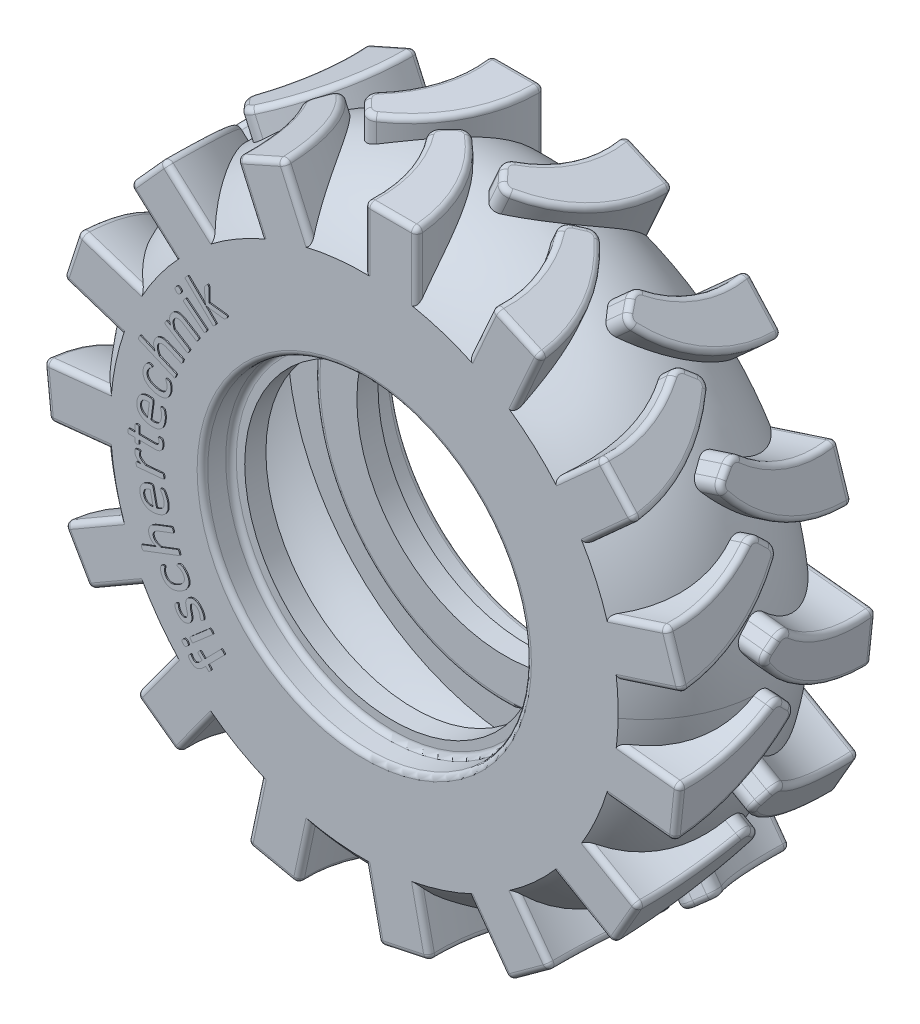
SolidWorks part; units mm, degrees
ref_plane "前视基准面" through (0, 0, 0) normal (0, 0, 1) x (1, 0, 0)
ref_plane "上视基准面" through (0, 0, 0) normal (0, 1, 0) x (1, 0, 0)
ref_plane "右视基准面" through (0, 0, 0) normal (1, 0, 0) x (0, 0, -1)
sketch "草图1" plane through (0, 0, 0) normal (0, 1, 0) x (1, 0, 0)
  line L0 (0, 0) -> (0, 9) construction
  line L1 (0, 0) -> (0, -9) construction
  line L2 (0, 0) -> (28.5, 0) construction
  line L3 (0, 9) -> (14, 9) construction
  line L4 (0, 9) -> (15.3, 9) construction
  line L5 (0, 0) -> (0, 6.3) construction
  line L6 (0, 6.3) -> (14, 6.3) construction
  line L7 (14, 6.3) -> (14.8, 6.3)
  line L8 (15.3, 6.8) -> (15.3, 8.5)
  line L9 (15.8, 9) -> (24, 9)
  line L10 (14, 6.3) -> (14, 4.3)
  line L11 (14, 4.3) -> (17.5, 4.3)
  line L12 (18, 4.8) -> (18, 5.8)
  line L13 (18.5, 6.3) -> (22.5766, 6.3)
  line L14 (18.5, -6.3) -> (22.5766, -6.3)
  line L15 (18, -4.8) -> (18, -5.8)
  line L16 (14, -4.3) -> (17.5, -4.3)
  line L17 (14, -6.3) -> (14, -4.3)
  line L18 (14, -6.3) -> (14.8, -6.3)
  line L19 (15.3, -6.8) -> (15.3, -8.5)
  line L20 (15.8, -9) -> (24, -9)
  arc A0 (14.8, 6.3) -> (15.3, 6.8) centre (14.8, 6.8) ccw
  arc A1 (18, 5.8) -> (18.5, 6.3) centre (18.5, 5.8) cw
  arc A2 (17.5, 4.3) -> (18, 4.8) centre (17.5, 4.8) ccw
  arc A3 (15.3, 8.5) -> (15.8, 9) centre (15.8, 8.5) cw
  arc A4 (18, -5.8) -> (18.5, -6.3) centre (18.5, -5.8) ccw
  arc A5 (17.5, -4.3) -> (18, -4.8) centre (17.5, -4.8) cw
  arc A6 (14.8, -6.3) -> (15.3, -6.8) centre (14.8, -6.8) cw
  arc A7 (15.3, -8.5) -> (15.8, -9) centre (15.8, -8.5) ccw
  arc A8 (24, -9) -> (24, 9) centre (17.25, 0) ccw
  arc A9 (22.5766, -6.3) -> (22.5766, 6.3) centre (17.25, 0) ccw
  circle A11 centre (17.25, 0) radius 8.25 construction
  circle A12 centre (17.25, 0) radius 11.25 construction
  point P17 (15.3, 6.3)
  point P20 (18, 6.3)
  point P23 (18, 4.3)
  point P46 (17.25, 11.25)
  point P47 (25.5, 0)
  dimension "D12" = 0.5
  dimension "D13" = 0.5
  dimension "D14" = 0.5
  dimension "D1" = 9
  dimension "D2" = 9
  dimension "D3" = 28.5
  dimension "D4" = 14
  dimension "D5" = 15.3
  dimension "D6" = 6.3
  dimension "D7" = 2
  dimension "D8" = 4
  dimension "D9" = 1.3
  dimension "D10" = 24
  dimension "D11" = 2
  dimension "D15" = 3
revolve "旋转1" add sketch "草图1" angle 360 about L0
ref_plane "基准面1" through (0, 30, 0) normal (0, 1, 0) x (1, 0, 0)
sketch "草图2" plane through (0, 30, 0) normal (0, 1, 0) x (1, 0, 0)
  line L0 (0, 0) -> (0, -9) construction
  line L1 (-24, -9) -> (24, -9) construction
  line L2 (0, 0) -> (0, 9) construction
  line L3 (15.8, 9) -> (-15.8, 9) construction
  line L4 (0, -9) -> (5, -9)
  line L5 (0, 0) -> (-3, 0) construction
  line L6 (-3, 0) -> (-3, 2) construction
  line L7 (-3, 2) -> (-1, 2) construction
  line L8 (-3, 0) -> (-1, 2)
  line L9 (0, 9) -> (-1, 9) construction
  line L10 (-1, 9) -> (-24, 9) construction
  line L11 (-24, 9) -> (-25, 9) construction
  line L12 (-1, 9) -> (-6, 9)
  line L13 (-6, 9) -> (-6, 0) construction
  line L14 (-6, 0) -> (-9, 0) construction
  line L15 (-9, 0) -> (-9, -2) construction
  line L16 (-9, -2) -> (-7, -2) construction
  line L17 (-9, 0) -> (-7, -2)
  arc A0 (5, -9) -> (-1, 2) centre (-9.5, -9.7727) ccw
  arc A1 (0, -9) -> (-3, 0) centre (-12, -8) ccw
  arc A2 (-7, -2) -> (-1, 9) centre (-13, 8.4091) ccw
  arc A3 (-9, 0) -> (-6, 9) centre (-15.5, 7.1667) ccw
  dimension "D1" = 5
  dimension "D2" = 3
  dimension "D3" = 2
  dimension "D4" = 2
  dimension "D5" = 1
  dimension "D6" = 1
  dimension "D7" = 5
  dimension "D8" = 9
  dimension "D9" = 3
  dimension "D10" = 90
  dimension "D11" = 2
  dimension "D12" = 2
extrude "凸台-拉伸1" add sketch "草图2" against normal up to surface (6 mm away)
fillet "圆角1" radius 1 4 edges at (-1, 29.1516, -2) (-3, 29.1708, 0) (-9, 28.5208, 0) (-7, 28.721, 2)
fillet "圆角2" radius 0.5 16 edges at (0, 27, 9) (5, 26.7367, 9) (2.5, 30, 9) (3.4592, 30, 3.2225) (-0.9627, 30, -1.6706) (-1.9893, 30, -1.0107) (-0.4458, 30, 4.6087) (-2.6483, 30, -0.0009) (-6.9509, 30, 1.7268) (-7.9277, 30, 1.0723) (-8.5866, 30, 0.0236) (-6.182, 30, -4.5616) (-2.2602, 30, -3.0233) (-3.5, 30, -9) (-1, 26.9896, -9) (-6, 26.619, -9)
pattern_circular "阵列(圆周)2" count 15 over 360 about axis through (0, 0, 0) along (0, 0, 1) of "凸台-拉伸1", "圆角1", "圆角2"
sketch "草图3" plane through (0, 0, 9) normal (0, 0, 1) x (1, 0, 0)
  circle A0 centre (0, 0) radius 19 construction
  text T0 "fischertechnik" font "Calibri" height 3.5
  dimension "D1" = 38
wrap "包覆1" sketch "草图3" wrap type emboss source sketch "草图3" thickness 0.1 parameters "D1"=0.1
sketch "草图4" plane through (0, 0, -9) normal (0, 0, -1) x (-1, 0, 0)
  circle A0 centre (0, 0) radius 19 construction
  text T0 "fischertechnik" font "Calibri" height 3.5
  dimension "D1" = 38
wrap "包覆2" sketch "草图4" wrap type emboss source sketch "草图4" thickness 0.1 parameters "D1"=0.1
